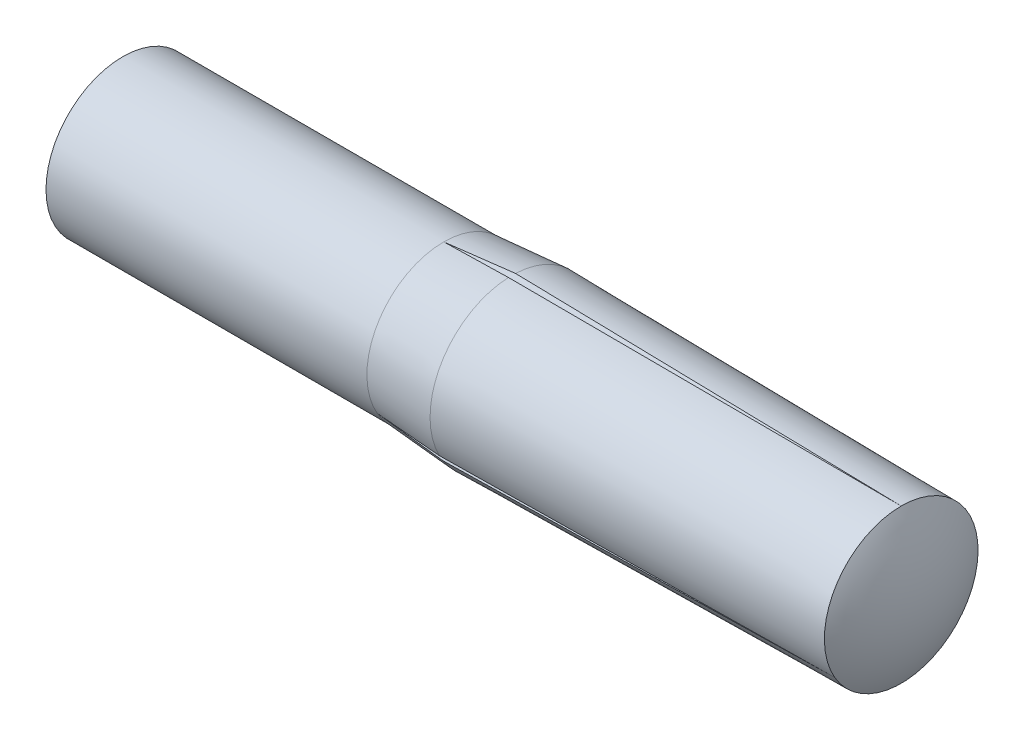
SolidWorks part; units mm, degrees
ref_plane "Plane1" through (0, 0, 0) normal (0, 0, 1) x (1, 0, 0)
ref_plane "Plane2" through (0, 0, 0) normal (0, 1, 0) x (1, 0, 0)
ref_plane "Plane3" through (0, 0, 0) normal (1, 0, 0) x (0, 0, -1)
sketch "Sketch1" plane through (0, 0, 0) normal (0, 0, 1) x (1, 0, 0)
  line L0 (0, 0) -> (24.8397, 0) construction
  line L1 (0.88, 0) -> (-0.88, 0) construction
  line L2 (0.2, 0.75) -> (3.3333, 0.75)
  line L4 (3.3333, 0.75) -> (4, 0.8)
  line L5 (4, 0.8) -> (7.8, 0.75)
  line L6 (0, 0) -> (8, 0)
  line L7 (8, 0) -> (8, -1.4225) construction
  arc A0 (0, 0) -> (0.2, 0.75) centre (1.5063, 0) cw
  arc A1 (7.8, 0.75) -> (8, 0) centre (6.4937, 0) cw
  dimension "D1" = 0.2
  dimension "c2" = 0.2
  dimension "d" = 1.5
  dimension "D3" = 4
  dimension "l" = 8
  dimension "D4" = 0.6667
  dimension "D2" = 1.6
  dimension "D5" = 1.5
revolve "Revolve2" add sketch "Sketch1" angle 360 about L0
sketch "Sketch2" plane through (0, 0, 0) normal (1, 0, 0) x (0, 0, -1)
  line L0 (0, 0.75) -> (-0.07, 0.85)
  line L1 (0, 0.8796) -> (0, -0.8796) construction
  line L2 (-0.07, 0.85) -> (0.07, 0.85)
  line L3 (0.07, 0.85) -> (0, 0.75)
  line L4 (0, 0.85) -> (0, 0.75) construction
  circle A0 centre (0, 0) radius 0.75 construction
  dimension "D1" = 0.1
  dimension "D2" = 70
extrude "Cut-Extrude2" cut sketch "Sketch2" along normal through all
pattern_circular "CirPattern2" count 3 over 360 about axis through (0, 0, 0) along (1, 0, 0) of "Cut-Extrude2"
equation "\"D1@Sketch1\" = \"c2@Sketch1\""
equation "\"D3@Sketch1\" = \"l@Sketch1\" / 2"
equation "\"D5@Sketch1\" = \"d@Sketch1\""
equation "\"D1@Sketch2\" = \"D2@Sketch1\" - \"d@Sketch1\""
equation "\"D4@Sketch1\" = \"D3@Sketch1\" / 6"
